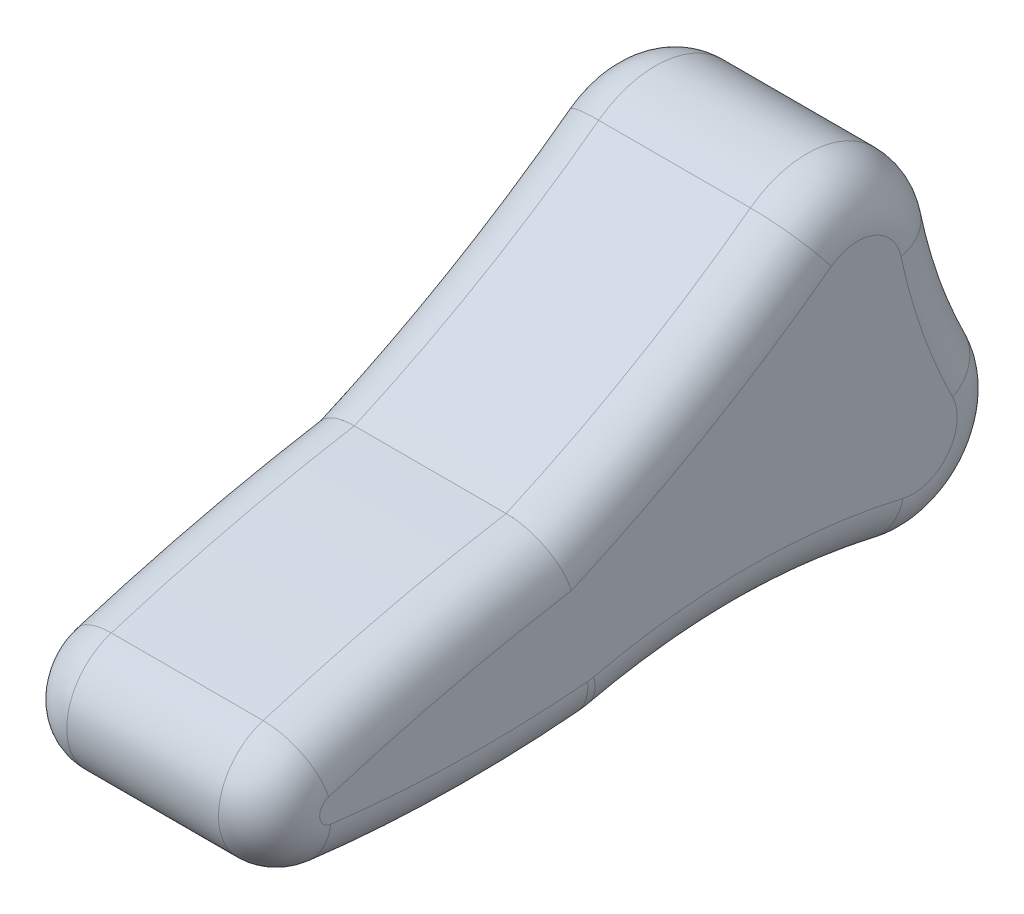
SolidWorks part; units mm, degrees
ref_plane "XY" through (0, 0, 0) normal (0, 0, 1) x (1, 0, 0)
ref_plane "YZ" through (0, 0, 0) normal (0, 1, 0) x (1, 0, 0)
ref_plane "XZ" through (0, 0, 0) normal (1, 0, 0) x (0, 0, -1)
ref_plane "Leg-plane" through (114.3, 0, 0) normal (1, 0, 0) x (0, 0, -1)
sketch "Sketch11" plane through (114.3, 0, 0) normal (1, 0, 0) x (0, 0, -1)
  line L0 (48.1295, -1222.515) -> (25.9157, -1159.015) construction
  line L1 (48.1295, -1222.515) -> (-84.0695, -1222.515) construction
  line L2 (-84.0695, -1222.515) -> (25.9157, -1159.015) construction
  line L3 (0, 432.2232) -> (0, -432.2232) construction
  line L4 (-246.7387, -1260.615) -> (307.6517, -1260.615) construction
  arc A0 (63.1782, -1151.0705) -> (3.1582, -1128.4584) centre (25.9157, -1159.015) ccw
  arc A1 (39.5078, -1259.6267) -> (82.2186, -1205.4991) centre (48.1295, -1222.515) ccw
  arc A2 (-99.1536, -1187.5282) -> (-75.4478, -1259.6267) centre (-84.0695, -1222.515) ccw
  arc A3 (82.2186, -1205.4991) -> (63.1782, -1151.0705) centre (286.7533, -1103.4035) cw
  arc A4 (39.5078, -1259.6267) -> (-75.4478, -1259.6267) centre (-17.97, -1507.0379) ccw
  arc A5 (-99.1536, -1187.5282) -> (3.1582, -1128.4584) centre (-300.2747, -721.0367) ccw
  dimension "D1" = 38.1
  dimension "D2" = 38.1
  dimension "D3" = 254
  dimension "D4" = 508
  dimension "D5" = 101.6
  dimension "D6" = 228.6
  dimension "D7" = 19.281
  dimension "D8" = 127
extrude "Base-Extrude" add sketch "Sketch11" along normal mid plane 101.6
sketch "Sketch12" plane through (114.3, 0, 0) normal (1, 0, 0) x (0, 0, -1)
  line L0 (-185.1062, -1233.199) -> (-84.0695, -1222.515) construction
  line L1 (0, 432.2232) -> (0, -432.2232) construction
  arc A0 (-80.7677, -1260.4717) -> (-90.1885, -1184.9096) centre (-84.0695, -1222.515) ccw
  arc A1 (-192.5992, -1208.9294) -> (-188.2807, -1258.3999) centre (-185.1062, -1233.199) ccw
  arc A2 (-192.5992, -1208.9294) -> (-90.1885, -1184.9096) centre (32.1918, -1937.018) cw
  arc A3 (-188.2807, -1258.3999) -> (-80.7677, -1260.4717) centre (-124.7917, -754.3829) ccw
  dimension "D2" = 762
  dimension "D3" = 25.4
  dimension "D4" = 38.1
  dimension "D5" = 508
  dimension "D1" = 96.036
  dimension "D6" = 101.6
extrude "Boss-Extrude1" add sketch "Sketch12" along normal mid plane 101.6
fillet "Fillet1" radius 20.32 18 edges at (165.1, -1159.8331, 44.3026) (165.1, -1253.0379, 17.97) (63.5, -1260.1433, 78.0928) (165.1, -1246.1161, -78.0393) (165.1, -1260.1433, 78.0928) (165.1, -1195.7079, 144.1694) (165.1, -1235.408, 210.41) (165.1, -1262.2886, 134.5792) (63.5, -1195.7079, 144.1694) (63.5, -1235.408, 210.41) (63.5, -1262.2886, 134.5792) (165.1, -1178.8876, -70.9754) (63.5, -1246.1161, -78.0393) (63.5, -1253.0379, 17.97) (165.1, -1123.3613, -39.348) (63.5, -1159.8331, 44.3026) (63.5, -1123.3613, -39.348) (63.5, -1178.8876, -70.9754)
